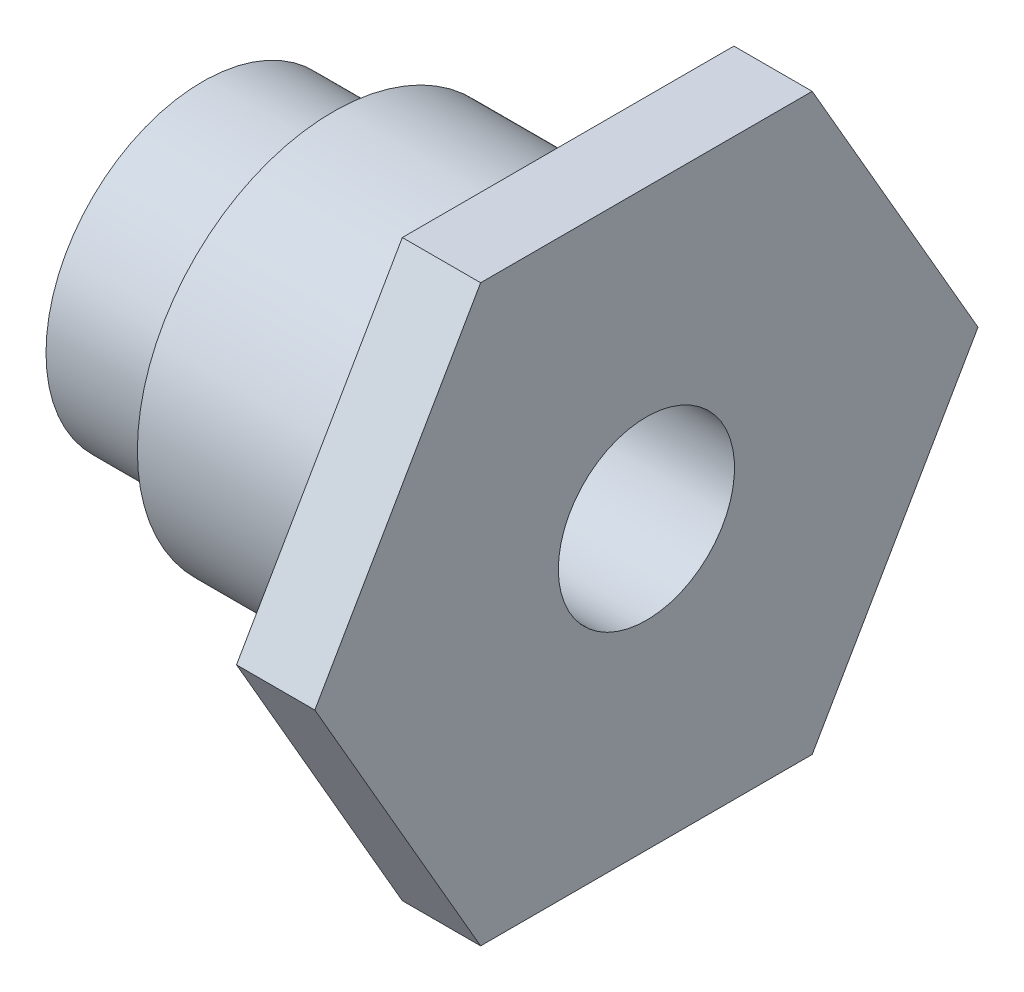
SolidWorks part; units mm, degrees
ref_plane "Plan de face" through (0, 0, 0) normal (0, 0, 1) x (1, 0, 0)
ref_plane "Plan de dessus" through (0, 0, 0) normal (0, 1, 0) x (1, 0, 0)
ref_plane "Plan de droite" through (0, 0, 0) normal (1, 0, 0) x (0, 0, -1)
sketch "Esquisse1" plane through (0, 0, 0) normal (0, 0, 1) x (1, 0, 0)
  line L0 (0, 0) -> (27.0432, 0) construction
  line L1 (0, 6) -> (5, 6)
  line L2 (5, 6) -> (5, 7.5)
  line L3 (5, 7.5) -> (14, 7.5)
  line L4 (14, 7.5) -> (14, 17.5)
  line L5 (14, 17.5) -> (17, 17.5)
  line L6 (17, 17.5) -> (17, 3.375)
  line L7 (17, 3.375) -> (0, 3.375)
  line L8 (0, 3.375) -> (0, 6)
  dimension "D1" = 6.75
  dimension "D2" = 35
  dimension "D3" = 12
  dimension "D4" = 15
  dimension "D5" = 5
  dimension "D6" = 14
  dimension "D7" = 17
revolve "Révolution1" add sketch "Esquisse1" angle 360 about L0
sketch "Esquisse2" plane through (17, 0, 0) normal (1, 0, 0) x (0, 0, -1)
  line L1 (6.3509, 11) -> (-6.3509, 11)
  line L2 (-6.3509, 11) -> (-12.7017, 0)
  line L3 (-12.7017, 0) -> (-6.3509, -11)
  line L4 (-6.3509, -11) -> (6.3509, -11)
  line L5 (6.3509, -11) -> (12.7017, 0)
  line L6 (12.7017, 0) -> (6.3509, 11)
  circle A0 centre (0, 0) radius 11 construction
  circle A1 centre (0, 0) radius 24.5236
  dimension "D1" = 22
extrude "Enlèv. mat.-Extru.1" cut sketch "Esquisse2" against normal through all
